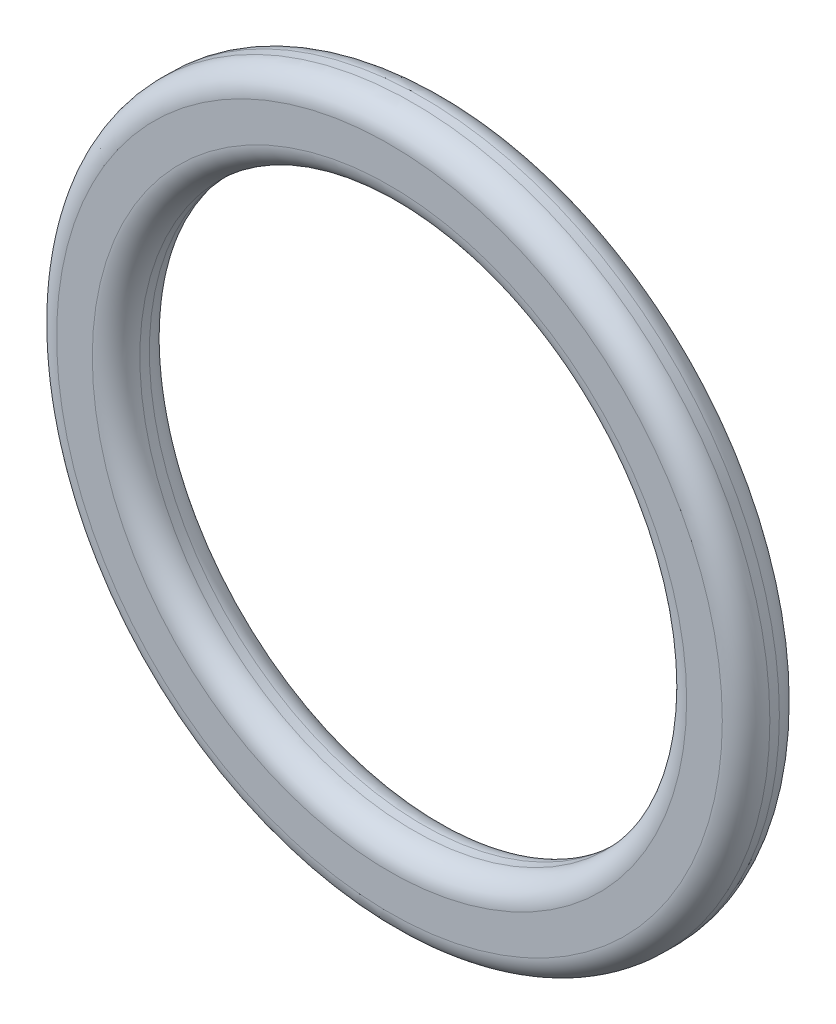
SolidWorks part; units mm, degrees
ref_plane "Plan de face" through (0, 0, 0) normal (0, 0, 1) x (1, 0, 0)
ref_plane "Plan de dessus" through (0, 0, 0) normal (0, 1, 0) x (1, 0, 0)
ref_plane "Plan de droite" through (0, 0, 0) normal (1, 0, 0) x (0, 0, -1)
sketch "Esquisse1" plane through (0, 0, 0) normal (1, 0, 0) x (0, 0, -1)
  line L0 (-20.8244, 0) -> (21.7431, 0) construction
  line L2 (1.4594, 15) -> (1.8594, 15)
  line L3 (0.4594, 14) -> (0.4594, 12.5)
  line L4 (1.4594, 11.5) -> (1.8594, 11.5)
  line L5 (2.8594, 14) -> (2.8594, 12.5)
  arc A0 (1.8594, 11.5) -> (2.8594, 12.5) centre (1.8594, 12.5) ccw
  arc A1 (1.8594, 15) -> (2.8594, 14) centre (1.8594, 14) cw
  arc A2 (1.4594, 15) -> (0.4594, 14) centre (1.4594, 14) ccw
  arc A3 (0.4594, 12.5) -> (1.4594, 11.5) centre (1.4594, 12.5) ccw
  dimension "D4" = 1
  dimension "D1" = 23
  dimension "D2" = 30
  dimension "D3" = 2.4
revolve "Révolution1" add sketch "Esquisse1" angle 360 about L0
